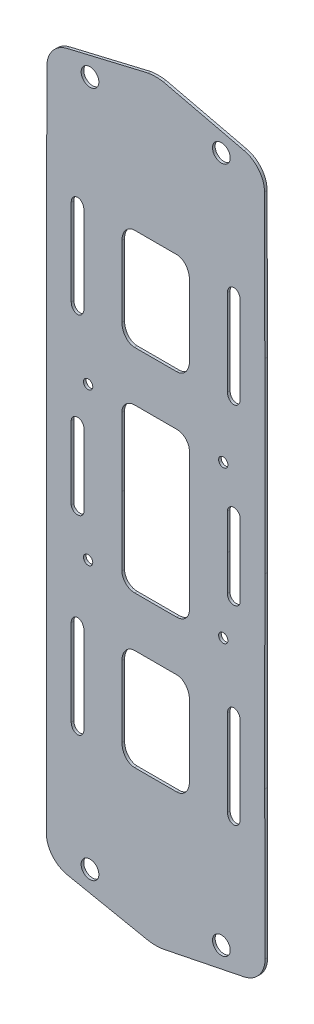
SolidWorks part; units mm, degrees
ref_plane "Спереди" through (0, 0, 0) normal (0, 0, 1) x (1, 0, 0)
ref_plane "Сверху" through (0, 0, 0) normal (0, 1, 0) x (1, 0, 0)
ref_plane "Справа" through (0, 0, 0) normal (1, 0, 0) x (0, 0, -1)
sketch "Эскиз1" plane through (0, 0, 0) normal (0, 0, 1) x (1, 0, 0)
  line L0 (20.6558, 35.3014) -> (20.6008, 62.6267)
  line L1 (0, 0) -> (0, 94.9232) construction
  line L2 (-20.6558, 35.3014) -> (-20.6008, 62.6267)
  line L3 (-20.6382, -35.2665) -> (-20.7062, -63.1008)
  line L4 (-20.6558, 0) -> (-20.6382, -35.2665)
  line L5 (-15.992, 0) -> (-15.992, -7.0144)
  line L6 (15.992, 6.8016) -> (15.992, 0)
  line L7 (13.592, 0) -> (13.592, 6.8016)
  line L8 (15.992, 42.6106) -> (15.992, 26.2906)
  line L9 (13.592, 26.2906) -> (13.592, 42.6106)
  line L10 (-6.392, 0) -> (-6.3923, -13.0023)
  line L11 (20.6382, -35.2665) -> (20.7062, -63.1008)
  line L12 (1.4357, 71.1085) -> (16.7528, 67.4822)
  line L13 (-3.992, 15.4016) -> (3.992, 15.4016)
  line L16 (6.392, 13.0016) -> (6.392, 0)
  line L18 (6.392, -41.1706) -> (6.392, -27.7306)
  line L19 (-3.992, -44.0506) -> (3.992, -44.0506)
  line L20 (-3.992, -24.8506) -> (3.992, -24.8506)
  line L21 (-3.992, 24.8506) -> (3.992, 24.8506)
  line L22 (-3.992, 44.0506) -> (3.992, 44.0506)
  line L23 (-3.9532, -15.4016) -> (3.9532, -15.4016)
  line L24 (6.392, 41.1706) -> (6.392, 27.7306)
  line L26 (1.3462, -71.1243) -> (16.6992, -68.0134)
  line L27 (20.6558, 35.3014) -> (20.6558, 0)
  line L28 (13.592, -26.2906) -> (13.592, -42.6106)
  line L29 (15.992, -42.6106) -> (15.992, -26.2906)
  line L30 (13.592, 0) -> (13.5753, -6.731)
  line L31 (6.392, 0) -> (6.3923, -13.0023)
  line L32 (15.992, 0) -> (15.992, -7.0144)
  line L33 (20.6558, 0) -> (20.6382, -35.2665)
  line L34 (-13.592, 0) -> (-13.5753, -6.731)
  line L35 (-15.992, -42.6106) -> (-15.992, -26.2906)
  line L39 (-13.592, -26.2906) -> (-13.592, -42.6106)
  line L40 (-20.6558, 35.3014) -> (-20.6558, 0)
  line L41 (-1.3462, -71.1243) -> (-16.6992, -68.0134)
  line L43 (-6.392, 41.1706) -> (-6.392, 27.7306)
  line L44 (-6.392, -41.1706) -> (-6.392, -27.7306)
  line L46 (-6.392, 13.0016) -> (-6.392, 0)
  line L48 (0, 0) -> (0, 62.4198) construction
  line L49 (0, 0) -> (0, -77.9632) construction
  line L51 (-1.4357, 71.1085) -> (-16.7528, 67.4822)
  line L53 (-13.592, 26.2906) -> (-13.592, 42.6106)
  line L54 (-15.992, 42.6106) -> (-15.992, 26.2906)
  line L55 (-13.592, 0) -> (-13.592, 6.8016)
  line L56 (-15.992, 6.8016) -> (-15.992, 0)
  arc A0 (20.6008, 62.6267) -> (16.7528, 67.4822) centre (15.6008, 62.6167) ccw
  arc A1 (-20.6008, 62.6267) -> (-16.7528, 67.4822) centre (-15.6008, 62.6167) cw
  circle A2 centre (12.792, 14.4016) radius 0.88
  arc A3 (20.7062, -63.1008) -> (16.6992, -68.0134) centre (15.7063, -63.113) cw
  arc A4 (-20.7062, -63.1008) -> (-16.6992, -68.0134) centre (-15.7063, -63.113) ccw
  arc A7 (15.992, 6.8016) -> (13.592, 6.8016) centre (14.792, 6.8016) ccw
  circle A8 centre (12.437, 64.959) radius 1.68
  arc A9 (1.4357, 71.1085) -> (0, 71.2263) centre (0, 62.4198) ccw
  arc A11 (6.392, 13.0016) -> (3.992, 15.4016) centre (3.992, 13.0016) ccw
  arc A36 (6.3923, -13.0023) -> (3.9532, -15.4016) centre (3.992, -13.0016) cw
  arc A38 (1.3462, -71.1243) -> (0, -71.2278) centre (0, -62.4198) cw
  circle A39 centre (12.437, -64.959) radius 1.68
  arc A40 (15.992, -7.0144) -> (13.5753, -6.731) centre (14.792, -6.8016) cw
  circle A43 centre (12.792, -14.4016) radius 0.88
  circle A55 centre (-12.792, -14.4016) radius 0.88
  arc A65 (-15.992, -7.0144) -> (-13.5753, -6.731) centre (-14.792, -6.8016) ccw
  circle A66 centre (-12.437, -64.959) radius 1.68
  arc A67 (-1.3462, -71.1243) -> (0, -71.2278) centre (0, -62.4198) ccw
  arc A69 (-6.3923, -13.0023) -> (-3.9532, -15.4016) centre (-3.992, -13.0016) ccw
  arc A94 (-6.392, 13.0016) -> (-3.992, 15.4016) centre (-3.992, 13.0016) cw
  arc A96 (-1.4357, 71.1085) -> (0, 71.2263) centre (0, 62.4198) cw
  circle A97 centre (-12.437, 64.959) radius 1.68
  arc A98 (-15.992, 6.8016) -> (-13.592, 6.8016) centre (-14.792, 6.8016) cw
  circle A102 centre (-12.792, 14.4016) radius 0.88
  ellipse E0 centre (3.992, -41.1706) end of major axis (3.992, -38.2906) minor radius 2.4 (6.392, -41.1706) -> (3.992, -44.0506) cw
  ellipse E1 centre (3.992, -27.7306) end of major axis (3.992, -24.8506) minor radius 2.4 (3.992, -24.8506) -> (6.392, -27.7306) cw
  ellipse E2 centre (14.792, -42.6106) end of major axis (14.792, -41.1706) minor radius 1.2 (15.992, -42.6106) -> (13.592, -42.6106) cw
  ellipse E3 centre (14.792, -26.2906) end of major axis (14.792, -24.8506) minor radius 1.2 (13.592, -26.2906) -> (15.992, -26.2906) cw
  ellipse E4 centre (14.792, 26.2906) end of major axis (14.792, 27.7306) minor radius 1.2 (13.592, 26.2906) -> (15.992, 26.2906) ccw
  ellipse E5 centre (14.792, 42.6106) end of major axis (14.792, 44.0506) minor radius 1.2 (15.992, 42.6106) -> (13.592, 42.6106) ccw
  ellipse E6 centre (-3.992, 41.1706) end of major axis (-3.992, 38.2906) minor radius 2.4 (-6.392, 41.1706) -> (-3.992, 44.0506) cw
  ellipse E7 centre (-3.992, 27.7306) end of major axis (-3.992, 24.8506) minor radius 2.4 (-3.992, 24.8506) -> (-6.392, 27.7306) cw
  ellipse E8 centre (-14.792, 42.6106) end of major axis (-14.792, 41.1706) minor radius 1.2 (-15.992, 42.6106) -> (-13.592, 42.6106) cw
  ellipse E9 centre (-14.792, 26.2906) end of major axis (-14.792, 24.8506) minor radius 1.2 (-13.592, 26.2906) -> (-15.992, 26.2906) cw
  ellipse E10 centre (-14.792, -26.2906) end of major axis (-14.792, -24.8506) minor radius 1.2 (-13.592, -26.2906) -> (-15.992, -26.2906) ccw
  ellipse E11 centre (-14.792, -42.6106) end of major axis (-14.792, -41.1706) minor radius 1.2 (-15.992, -42.6106) -> (-13.592, -42.6106) ccw
  ellipse E12 centre (-3.992, -27.7306) end of major axis (-3.992, -24.8506) minor radius 2.4 (-3.992, -24.8506) -> (-6.392, -27.7306) ccw
  ellipse E13 centre (3.992, 27.7306) end of major axis (3.992, 24.8506) minor radius 2.4 (3.992, 24.8506) -> (6.392, 27.7306) ccw
  ellipse E14 centre (-3.992, -41.1706) end of major axis (-3.992, -38.2906) minor radius 2.4 (-6.392, -41.1706) -> (-3.992, -44.0506) ccw
  ellipse E15 centre (3.992, 41.1706) end of major axis (3.992, 44.0506) minor radius 2.4 (6.392, 41.1706) -> (3.992, 44.0506) ccw
  point P1 (0.0016, 0.0016)
  point P2 (0.0016, 0)
  point P12 (20.5929, 66.573)
  point P15 (-20.5929, 66.573)
  point P19 (20.7163, -67.1995)
  point P70 (-20.7163, -67.1995)
  point P127 (0, -24.8506)
  point P140 (0, 24.8506)
  point P174 (0, -44.0506)
  point P176 (0, 44.0506)
  point P383 (0, -15.4016)
  point P384 (0, 15.4016)
  point P386 (-0.0016, 0)
  point P387 (-0.0016, 0.0016)
extrude "Бобышка-Вытянуть3" add sketch "Эскиз1" along normal blind 0.5
